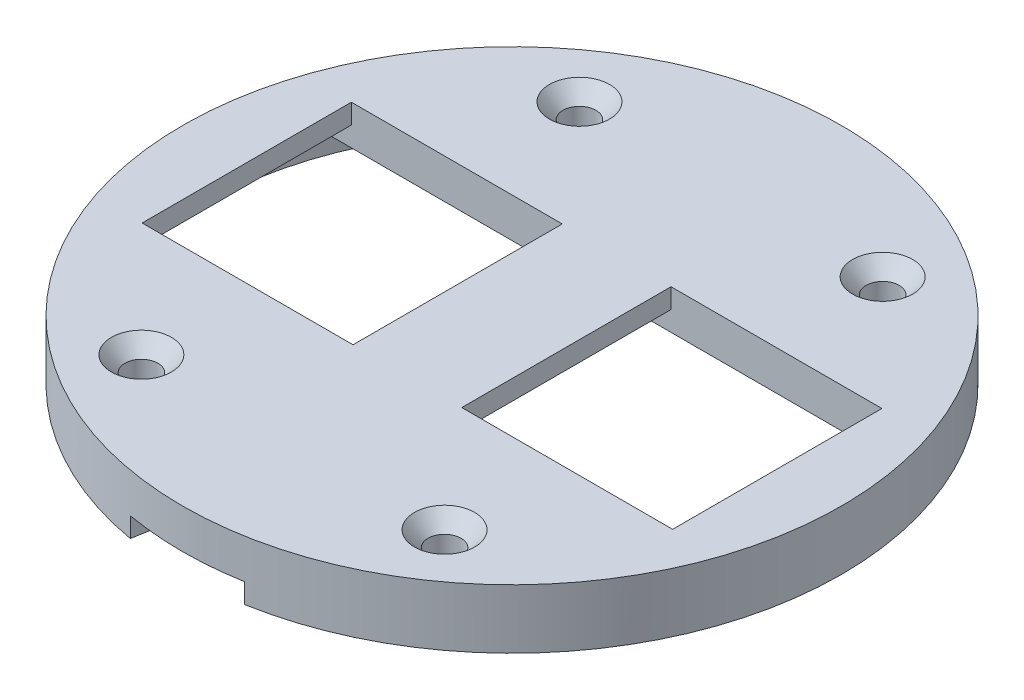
SolidWorks part; units mm, degrees
other "<a_base>-<Supports>"
ref_plane "Front Plane" through (0, 0, 0) normal (0, 0, 1) x (1, 0, 0)
ref_plane "Top Plane" through (0, 0, 0) normal (0, 1, 0) x (1, 0, 0)
ref_plane "Right Plane" through (0, 0, 0) normal (1, 0, 0) x (0, 0, -1)
inserted part "a_base"
sketch "Sketch1" plane through (0, 0, 0) normal (0, -1, 0) x (1, 0, 0)
  circle A0 centre (0, 0) radius 50 construction
  circle A1 centre (0, 0) radius 50
  circle A2 centre (0, 0) radius 47
  dimension "D1" = 3
extrude "Rim" add sketch "Sketch1" along normal blind 6
sketch "Sketch2" plane through (0, -6, 0) normal (0, -1, 0) x (1, 0, 0)
  line L0 (0, 0) -> (0, 50) construction
  line L1 (0, 0) -> (-50, 0) construction
  line L2 (0, 0) -> (-8.6824, 49.2404) construction
  line L3 (0, 0) -> (8.6824, 49.2404) construction
  line L4 (-8.6824, 49.2404) -> (-8.1615, 46.286)
  line L5 (8.6824, 49.2404) -> (8.1615, 46.286)
  line L6 (8.6824, -49.2404) -> (8.1615, -46.286)
  line L7 (-8.6824, -49.2404) -> (-8.1615, -46.286)
  circle A0 centre (0, 0) radius 50 construction
  circle A1 centre (0, 0) radius 47 construction
  arc A2 (8.6824, 49.2404) -> (-8.6824, 49.2404) centre (0, 0) ccw
  arc A3 (8.1615, 46.286) -> (-8.1615, 46.286) centre (0, 0) ccw
  arc A4 (8.1615, -46.286) -> (-8.1615, -46.286) centre (0, 0) cw
  arc A5 (8.6824, -49.2404) -> (-8.6824, -49.2404) centre (0, 0) cw
  dimension "D1" = 20
extrude "Flange Clearance" cut sketch "Sketch2" against normal blind 3
sketch "Sketch3" plane through (0, 0, 0) normal (0, -1, 0) x (1, 0, 0)
  line L0 (0, 47) -> (0, 0) construction
  line L1 (0, 0) -> (47, 0) construction
  line L2 (29.5, 36.5889) -> (29.5, -36.5889) construction
  line L3 (40.25, -15.875) -> (40.25, 15.875)
  line L4 (-8.25, 15.875) -> (-8.25, -15.875)
  line L5 (-40.25, 15.875) -> (-8.25, 15.875)
  line L6 (40.25, 15.875) -> (8.25, 15.875)
  line L7 (8.25, 15.875) -> (8.25, -15.875)
  line L8 (8.25, -15.875) -> (40.25, -15.875)
  line L9 (-8.25, -15.875) -> (-40.25, -15.875)
  line L10 (-40.25, -15.875) -> (-40.25, 15.875)
  circle A0 centre (0, 0) radius 47 construction
  point P5 (38.75, 0)
  point P10 (-38.75, 0)
  dimension "D1" = 29.5
  dimension "D2" = 9.25
  dimension "D3" = 1.5
  dimension "D4" = 31.75
  dimension "D5" = 32
extrude "Finger Clearance" cut sketch "Sketch3" against normal through all
sketch "Sketch4" plane through (0, 0, 0) normal (0, -1, 0) x (1, 0, 0)
  line L4 (-8.25, 15.875) -> (-40.25, 15.875) construction
  line L5 (-4.25, 15.875) -> (-44.25, 15.875)
  line L6 (-4.25, 15.875) -> (-4.25, -15.875)
  line L7 (-4.25, -15.875) -> (-44.25, -15.875)
  line L8 (-44.25, 15.875) -> (-44.25, -15.875)
  line L9 (-40.25, -15.875) -> (-8.25, -15.875) construction
  line L10 (-40.25, 15.875) -> (-40.25, -15.875) construction
  line L11 (-8.25, -15.875) -> (-8.25, 15.875) construction
  line L12 (0, 0) -> (-47, 0) construction
  line L13 (4.25, 15.875) -> (4.25, -15.875)
  line L14 (4.25, -15.875) -> (44.25, -15.875)
  line L15 (44.25, 15.875) -> (44.25, -15.875)
  line L19 (4.25, 15.875) -> (44.25, 15.875)
  line L29 (-39.7459, 18.875) -> (-1.25, 18.875)
  line L30 (-1.25, 18.875) -> (-1.25, -18.875)
  line L31 (-1.25, -18.875) -> (-39.7459, -18.875)
  line L33 (1.25, 18.875) -> (1.25, -18.875)
  line L34 (1.25, -18.875) -> (39.7459, -18.875)
  line L35 (1.25, 18.875) -> (39.7459, 18.875)
  line L36 (0, 44) -> (0, -44) construction
  arc A0 (-28.4921, 33.5291) -> (-39.7459, 18.875) centre (0, 0) ccw
  circle A1 centre (0, 0) radius 47 construction
  arc A2 (-28.4921, 33.5291) -> (-21.3413, 38.4779) centre (-23, 33.234) ccw
  circle A3 centre (-23, 33.234) radius 2.5 construction
  circle A4 centre (-23, 33.234) radius 2.5
  circle A5 centre (23, 33.234) radius 2.5 construction
  circle A6 centre (23, -33.234) radius 2.5 construction
  circle A7 centre (-23, -33.234) radius 2.5 construction
  circle A8 centre (23, 33.234) radius 2.5
  circle A9 centre (23, -33.234) radius 2.5
  circle A10 centre (-23, -33.234) radius 2.5
  arc A11 (21.3413, 38.4779) -> (28.4921, 33.5291) centre (23, 33.234) ccw
  arc A12 (28.4921, -33.5291) -> (21.3413, -38.4779) centre (23, -33.234) ccw
  arc A13 (-21.3413, -38.4779) -> (-28.4921, -33.5291) centre (-23, -33.234) ccw
  arc A14 (21.3413, 38.4779) -> (-21.3413, 38.4779) centre (0, 0) ccw
  arc A15 (28.4921, -33.5291) -> (39.7459, -18.875) centre (0, 0) ccw
  arc A16 (-21.3413, -38.4779) -> (21.3413, -38.4779) centre (0, 0) ccw
  circle A17 centre (0, 0) radius 47
  arc A18 (-39.7459, -18.875) -> (-28.4921, -33.5291) centre (0, 0) ccw
  arc A19 (39.7459, 18.875) -> (28.4921, 33.5291) centre (0, 0) ccw
  dimension "D1" = 3
  dimension "D2" = 3
  dimension "D3" = 4
  dimension "D4" = 4
  dimension "D5" = 3
  dimension "D6" = 3
extrude "Inset Layer" add sketch "Sketch4" along normal up to surface (3 mm away) contours L13 L19 L5 L6 L7 L14 A19 L35 L33 L34 A15 A12 A16 A13 A18 L31 L30 L29 A0 A2 A14 A11 M14 M17 M60 M62 M12 M18 M20 M21 M19 | L8 M17 | L15 M17
fillet "Contouring" radius 1 16 edges at (39.7459, -1.5, 18.875) (28.4921, -1.5, 33.5291) (21.3413, -1.5, 38.4779) (1.25, -1.5, 18.875) (39.7459, -1.5, -18.875) (1.25, -1.5, -18.875) (28.4921, -1.5, -33.5291) (21.3413, -1.5, -38.4779) (-21.3413, -1.5, -38.4779) (-28.4921, -1.5, -33.5291) (-39.7459, -1.5, -18.875) (-1.25, -1.5, -18.875) (-1.25, -1.5, 18.875) (-39.7459, -1.5, 18.875) (-21.3413, -1.5, 38.4779) (-28.4921, -1.5, 33.5291)
hole_wizard "CSK for #8 Flat Head Socket Cap Screw1" positions "Sketch6" profile "Sketch5" countersink size "#8" standard "ANSI Inch"
sketch "Sketch6" plane through (0, 3, 0) normal (0, 1, 0) x (1, 0, 0)
  point P0 (-23, 33.234)
  point P3 (23, 33.234)
  point P6 (23, -33.234)
  point P9 (-23, -33.234)
sketch "Sketch5" plane through (-23, 3, -33.234) normal (1, 0, 0) x (0, 0, 1)
  line L0 (0, 0) -> (0, 9)
  line L1 (0, 9) -> (2.2479, 9)
  line L2 (2.2479, 9) -> (2.2479, 2.659)
  line L3 (2.2479, 2.659) -> (4.5593, 0)
  line L5 (4.5593, 0) -> (0, 0)
  line L6 (-2.2479, 2.659) -> (-4.5593, 0) construction
  line L11 (0, -6.35) -> (0, 107.95) construction
  dimension "Thru Hole Dia." = 4.4958
  dimension "Thru Hole Depth" = 9
  dimension "Near C'Sink Dia." = 9.1186
  dimension "Near C'Sink Angle" = 82
ref_point "Ref Center"
equation "\"D1@Sketch1\" = \"width keep@values@params_print.sldprt\""
equation "\"D1@Rim\" = 2 * \"width keep@values@params_print.sldprt\""
equation "\"D3@Sketch3\" = \"width keep@values@params_print.sldprt\" / 2"
equation "\"D4@Sketch3\" = \"depth@values@params_finger.sldprt\""
equation "\"D1@Sketch4\" = \"width keep@values@params_print.sldprt\""
equation "\"D2@Sketch4\" = \"width keep@values@params_print.sldprt\""
equation "\"D3@Sketch4\" = \"width tab@values@params_print.sldprt\""
equation "\"D4@Sketch4\" = \"width tab@values@params_print.sldprt\""
equation "\"D5@Sketch4\" = \"width keep@values@params_print.sldprt\""
equation "\"D6@Sketch4\" = \"width keep@values@params_print.sldprt\""
